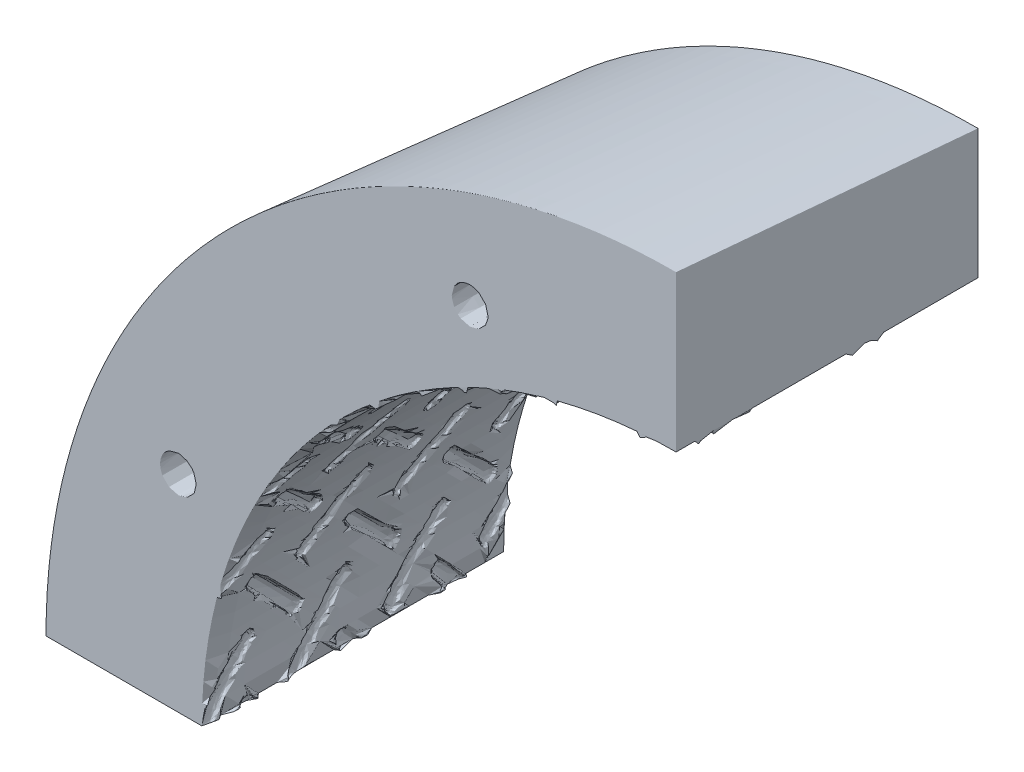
SolidWorks part; units mm, degrees
ref_plane "Plan de face" through (0, 0, 0) normal (0, 0, 1) x (1, 0, 0)
ref_plane "Plan de dessus" through (0, 0, 0) normal (0, 1, 0) x (1, 0, 0)
ref_plane "Plan de droite" through (0, 0, 0) normal (1, 0, 0) x (0, 0, -1)
sketch "Esquisse1" plane through (0, 0, 0) normal (0, 0, 1) x (1, 0, 0)
  line L0 (0, 0) -> (-70, 0)
  line L1 (0, 0) -> (0, 70)
  circle A2 centre (0, 0) radius 70
  circle A3 centre (0, 0) radius 55
  dimension "D1" = 110
  dimension "D2" = 140
extrude "Boss.-Extru.1" add sketch "Esquisse1" along normal blind 35 contours A3 L1 A2 L0
draft "Dépouille1" type of draft neutral plane draft angle 5 faces to draft 1 parameters "D1"=5
sketch "Sketch1" plane through (0, 0, 0) normal (0, 0, -1) x (-1, 0, 0)
  line L0 (0, 0) -> (26.7878, 64.6716) construction
  line L1 (0, 0) -> (21.0476, 50.8134) construction
  line L2 (21.0476, 50.8134) -> (26.7878, 64.6716) construction
  line L3 (0, 0) -> (0, 70) construction
  arc A0 (70, 0) -> (0, 70) centre (0, 0) ccw construction
  arc A1 (55, 0) -> (0, 55) centre (0, 0) ccw construction
  circle A6 centre (23.9177, 57.7425) radius 2.1
  circle A7 centre (57.7425, 23.9177) radius 2.1
  point P6 (23.9177, 57.7425)
  dimension "D4" = 2
  dimension "D3" = 4.2
  dimension "D1" = 62.5
  dimension "D2" = 22.5
extrude "Cut-Extrude1" cut sketch "Sketch1" against normal through all
other "3D Texture1"
other "Graphic (Closed) -1"
